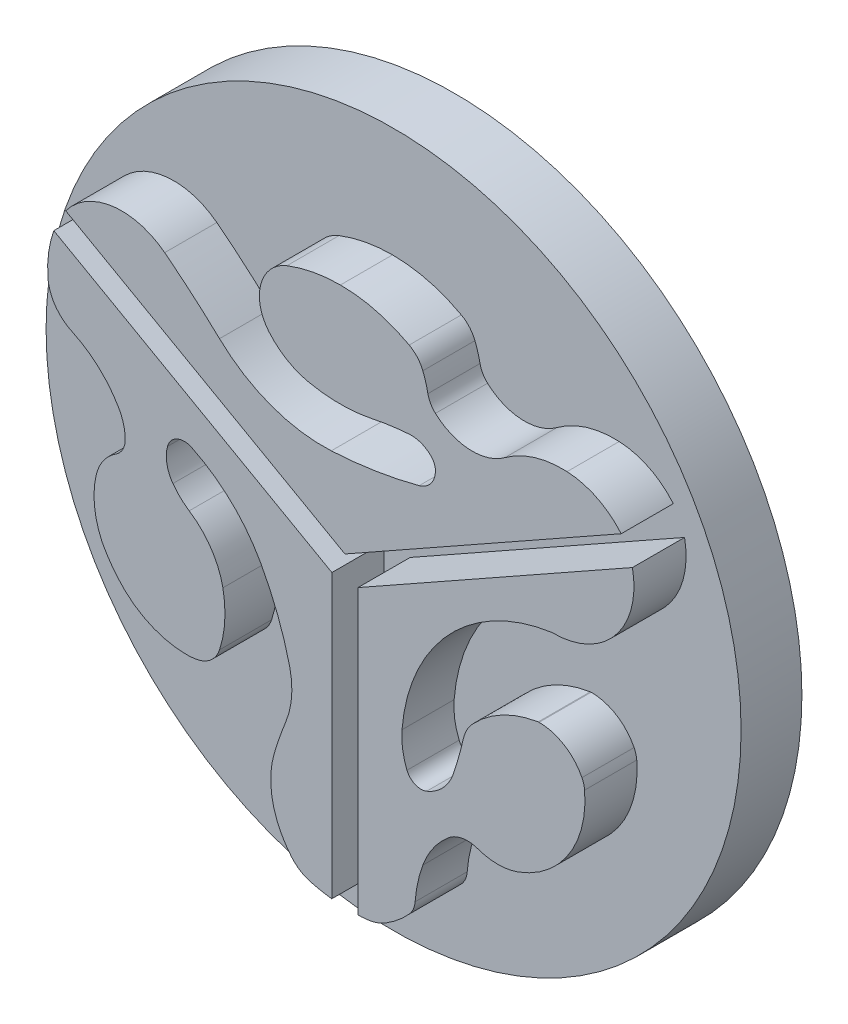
SolidWorks part; units mm, degrees
ref_plane "Alzado" through (0, 0, 0) normal (0, 0, 1) x (1, 0, 0)
ref_plane "Planta" through (0, 0, 0) normal (0, 1, 0) x (1, 0, 0)
ref_plane "Vista lateral" through (0, 0, 0) normal (1, 0, 0) x (0, 0, -1)
sketch "Croquis1" plane through (0, 0, 0) normal (0, 0, 1) x (1, 0, 0)
  circle A0 centre (0, 0) radius 40
  dimension "D1" = 80
extrude "Saliente-Extruir1" add sketch "Croquis1" along normal blind 7
sketch "Croquis2" plane through (0, 0, 7) normal (0, 0, 1) x (1, 0, 0)
  line L6 (-1.1008, -1.8329) -> (-1.116, -34.3663)
  line L7 (-31.7435, 18.9039) -> (0.4, 0.7649)
  line L8 (1.8992, -1.8338) -> (1.8982, -34.4802)
  line L9 (0.4, 0.7649) -> (32.1962, 18.6815)
  line L10 (-33.1124, 16.2398) -> (-1.1008, -1.8329)
  line L11 (1.8992, -1.8338) -> (33.4908, 15.9599)
  arc A65 (12.8798, -14.9135) -> (14.0285, -10.8399) centre (-28.8179, -0.9571) ccw
  arc A66 (7.796, -31.4376) -> (5.11, -33.6594) centre (-1.5134, -22.9177) cw
  arc A67 (-19.4006, -2.1124) -> (-17.5278, -3.8982) centre (-13.6494, 2.0442) ccw
  arc A68 (-6.2818, 26.1612) -> (-0.121, 27.3197) centre (-0.121, 10.3586) cw
  arc A69 (7.5429, -17.2222) -> (9.8056, -18.182) centre (9.1541, -16.5708) ccw
  arc A70 (15.6834, -20.9733) -> (12.2837, -21.586) centre (14.5153, -24.2299) ccw
  arc A71 (-27.4179, -12.258) -> (-27.6006, -11.8987) centre (-22.9584, -9.7636) cw
  arc A72 (-25.9588, -2.4488) -> (-24.8874, -0.4848) centre (-27.2231, -0.4848) ccw
  arc A73 (-33.7943, 11.2696) -> (-33.1124, 16.2398) centre (-21.3035, 12.0877) cw
  arc A74 (22.7485, -4.8426) -> (27.6815, -7.8897) centre (22.7485, -10.3592) cw
  arc A75 (18.8193, 19.582) -> (25.9667, 21.7587) centre (25.4399, 10.6652) cw
  arc A76 (24.235, 4.8542) -> (6.9678, -13.4681) centre (27.0335, -15.0808) ccw
  arc A77 (-3.5673, -33.8946) -> (-5.7549, -32.4952) centre (-2.4771, -29.7807) cw
  arc A78 (-9.3174, -4.9453) -> (-17.2381, 2.5531) centre (-25.0336, -13.6139) ccw
  arc A79 (7.796, 16.4101) -> (3.5292, 15.8134) centre (10.0846, -15.5094) ccw
  arc A80 (7.796, 25.2926) -> (9.365, 23.5128) centre (6.1196, 22.2333) cw
  arc A81 (8.4755, -29.8706) -> (7.796, -31.4376) centre (5.8633, -29.6687) cw
  arc A82 (-20.02, 1.2831) -> (-19.4006, -2.1124) centre (-16.1539, 0.234) ccw
  arc A83 (-3.7712, 15.8134) -> (-8.338, 18.5339) centre (-2.0957, 23.8194) cw
  arc A84 (9.9488, 21.5262) -> (10.8145, 19.9901) centre (12.7223, 22.0773) ccw
  arc A85 (27.6815, -7.8897) -> (27.9881, -8.9817) centre (25.0015, -9.2313) cw
  arc A86 (20.3921, -20.9459) -> (15.6834, -20.9733) centre (18.0003, -14.5141) cw
  arc A87 (-25.7379, -14.685) -> (-27.4179, -12.258) centre (-13.9052, -4.6996) cw
  arc A88 (-14.0367, 15.0102) -> (-1.1741, 10.2606) centre (-2.0828, 27.5916) ccw
  arc A89 (9.8056, -18.182) -> (12.8798, -14.9135) centre (7.796, -13.2119) ccw
  arc A90 (2.9104, -34.4056) -> (1.8982, -34.4802) centre (1.0733, -16.383) cw
  arc A91 (-13.6494, -9.6331) -> (-14.0367, -16.0109) centre (-25.9588, -12.0862) cw
  arc A92 (8.95, 11.8516) -> (10.8145, 14.2753) centre (8.3069, 14.2753) ccw
  arc A93 (-8.338, 18.5339) -> (-9.4133, 22.1258) centre (-4.7627, 21.5611) cw
  arc A94 (25.9667, 21.7587) -> (32.1962, 18.6815) centre (25.5546, 13.0801) cw
  arc A95 (33.4908, 15.9599) -> (24.235, 4.8542) centre (24.361, 14.159) cw
  arc A96 (-5.7549, -32.4952) -> (-6.9545, -30.711) centre (2.561, -25.6084) cw
  arc A97 (-17.5278, -3.8982) -> (-13.6494, -9.6331) centre (-22.4101, -11.379) cw
  arc A98 (-24.8874, -0.4848) -> (-25.6251, 2.2903) centre (-30.4764, -0.4848) ccw
  arc A99 (-25.6251, 2.2903) -> (-31.0189, 7.2311) centre (-36.0446, -3.6701) ccw
  arc A100 (-17.865, -18.3781) -> (-25.7379, -14.685) centre (-17.7884, -7.9766) cw
  arc A101 (-31.7435, 18.9039) -> (-20.346, 20.4317) centre (-25.2926, 14.0568) cw
  arc A102 (27.9881, -8.9817) -> (20.3921, -20.9459) centre (16.3061, -9.9582) cw
  arc A103 (12.2837, -21.586) -> (9.365, -25.7651) centre (18.6764, -29.1596) ccw
  arc A104 (-27.6006, -11.8987) -> (-28.2289, -5.6658) centre (-18.8348, -7.867) cw
  arc A105 (10.2945, 15.502) -> (7.796, 16.4101) centre (8.029, 13.1602) ccw
  arc A106 (10.8145, 19.9901) -> (18.8193, 19.582) centre (15.0643, 24.6394) ccw
  arc A107 (-6.3992, -19.3498) -> (-5.9641, -13.6191) centre (-15.1409, -15.8042) ccw
  arc A108 (-5.9641, -13.6191) -> (-9.3174, -4.9453) centre (-39.5361, -21.6131) ccw
  arc A109 (-28.2289, -5.6658) -> (-25.9588, -2.4488) centre (-23.1167, -6.8637) cw
  arc A110 (10.8145, 14.2753) -> (10.2945, 15.502) centre (9.1078, 14.2753) ccw
  arc A111 (14.0285, -10.8399) -> (15.1221, -8.8014) centre (18.3208, -11.83) cw
  arc A112 (-7.7285, -23.1459) -> (-6.3992, -19.3498) centre (32.0373, -34.9397) cw
  arc A113 (-1.116, -34.3663) -> (-3.5673, -33.8946) centre (1.0733, -16.383) cw
  arc A114 (6.9678, -13.4681) -> (7.5429, -17.2222) centre (15.1928, -14.1292) ccw
  arc A115 (5.11, -33.6594) -> (2.9104, -34.4056) centre (2.3836, -29.2378) cw
  arc A116 (-14.0367, -16.0109) -> (-16.5837, -18.2586) centre (-17.2296, -14.9598) cw
  arc A117 (3.5292, 15.8134) -> (-3.7712, 15.8134) centre (-0.121, 33.2548) cw
  arc A118 (9.365, 23.5128) -> (9.9488, 21.5262) centre (-1.3887, 19.2733) cw
  arc A119 (22.6395, -4.8511) -> (22.7485, -4.8426) centre (22.7485, -5.549) cw
  arc A120 (-1.1741, 10.2606) -> (8.95, 11.8516) centre (-3.7712, 59.796) ccw
  arc A121 (15.1221, -8.8014) -> (22.6395, -4.8511) centre (24.6684, -17.8401) cw
  arc A122 (9.365, -25.7651) -> (8.4755, -29.8706) centre (23.8962, -31.0625) ccw
  arc A123 (-16.5837, -18.2586) -> (-17.865, -18.3781) centre (-17.8177, -11.956) cw
  arc A124 (-31.0189, 7.2311) -> (-33.7943, 11.2696) centre (-29.0127, 11.5828) cw
  arc A125 (-20.346, 20.4317) -> (-14.0367, 15.0102) centre (-71.3939, -45.3574) cw
  arc A126 (-6.9545, -30.711) -> (-7.7285, -23.1459) centre (1.8536, -25.9877) cw
  arc A127 (-17.2381, 2.5531) -> (-20.02, 1.2831) centre (-18.1015, 0.7625) ccw
  arc A128 (-9.4133, 22.1258) -> (-6.2818, 26.1612) centre (-4.4748, 21.5262) cw
  arc A129 (-0.121, 27.3197) -> (7.796, 25.2926) centre (-0.121, 10.8453) cw
extrude "Saliente-Extruir2" add sketch "Croquis2" along normal blind 6
